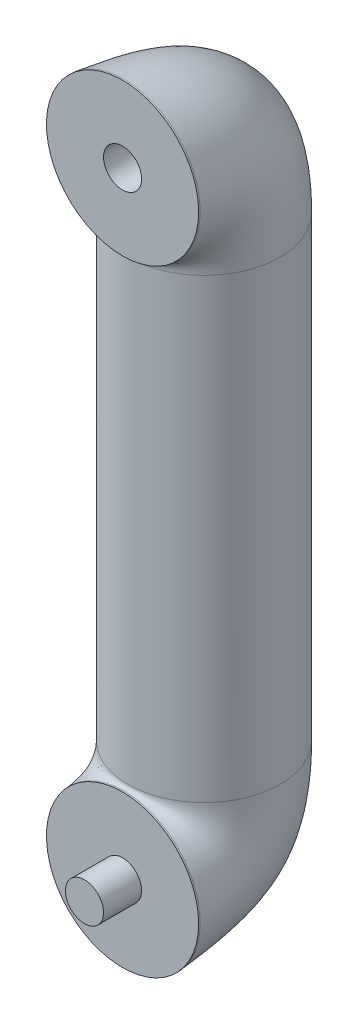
SolidWorks part; units mm, degrees
ref_plane "Ebene vorne" through (0, 0, 0) normal (0, 0, 1) x (1, 0, 0)
ref_plane "Ebene oben" through (0, 0, 0) normal (0, 1, 0) x (1, 0, 0)
ref_plane "Ebene rechts" through (0, 0, 0) normal (1, 0, 0) x (0, 0, -1)
sketch "Skizze1" plane through (0, 0, 0) normal (0, 0, 1) x (1, 0, 0)
  circle A0 centre (0, 0) radius 100
  dimension "D1" = 200
extrude "Aufsatz-Linear austragen1" add sketch "Skizze1" along normal blind 2
sketch "Skizze2" plane through (0, 0, 2) normal (0, 0, 1) x (1, 0, 0)
  circle A0 centre (0, 0) radius 25
  dimension "D1" = 50
extrude "Aufsatz-Linear austragen2" add sketch "Skizze2" along normal blind 50
ref_plane "Ebene1" through (0, 105, 0) normal (0, 1, 0) x (1, 0, 0)
sketch "Skizze4" plane through (0, 105, 0) normal (0, 1, 0) x (1, 0, 0)
  circle A0 centre (0, 105) radius 100
  dimension "D1" = 200
  dimension "D2" = 105
other "Begrenzung1"
sketch "Skizze5" plane through (0, 105, 0) normal (0, 1, 0) x (1, 0, 0)
  circle A1 centre (0, 105) radius 100 construction
  circle A2 centre (0, 105) radius 98
  circle A3 centre (0, 105) radius 98
  circle A4 centre (0, 105) radius 100
  dimension "D1" = 2
extrude "Aufsatz-Linear austragen3" add sketch "Skizze5" along normal blind 300
mirror "Spiegeln2" about plane through (0, 405, -105) normal (0, 1, 0)
sketch "Skizze6" plane through (0, 0, 52) normal (0, 0, 1) x (1, 0, 0)
  circle A2 centre (0, 810) radius 25
  circle A3 centre (0, 810) radius 25
  dimension "D1" = 0
extrude "Schnitt-Linear austragen1" cut sketch "Skizze6" against normal blind 100
